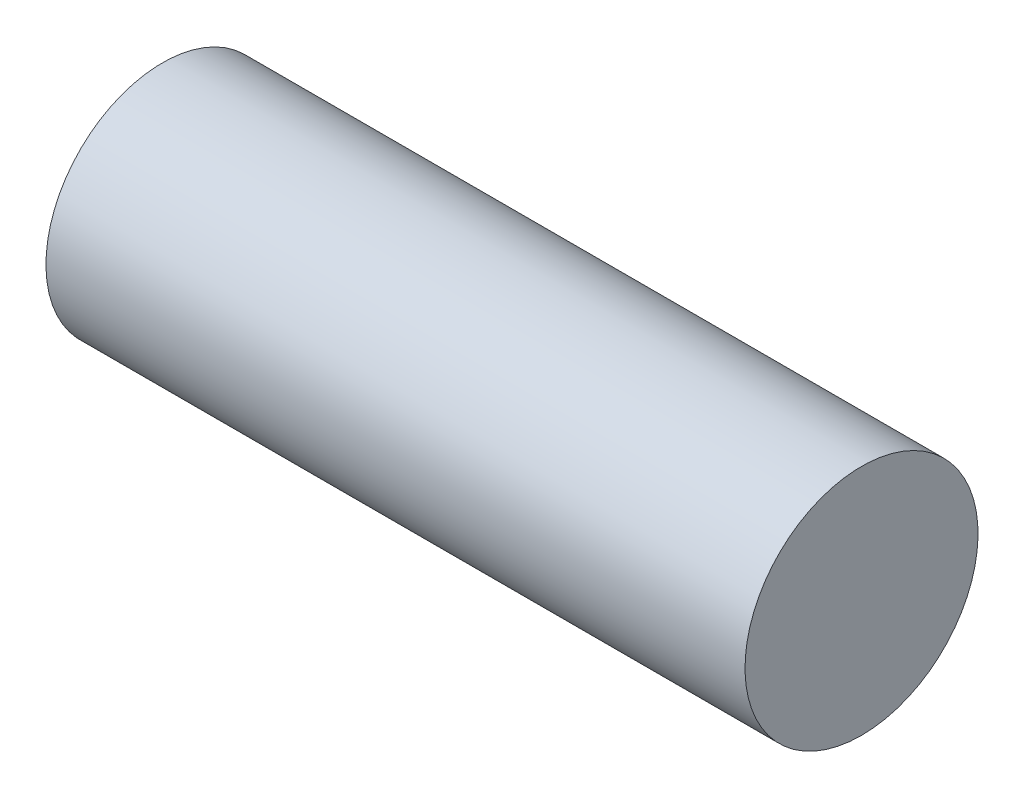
SolidWorks part; units mm, degrees
ref_plane "Plane1" through (0, 0, 0) normal (0, 0, 1) x (1, 0, 0)
ref_plane "Plane2" through (0, 0, 0) normal (0, 1, 0) x (1, 0, 0)
ref_plane "Plane3" through (0, 0, 0) normal (1, 0, 0) x (0, 0, -1)
other "Configuration Table"
sketch "BodySke" plane through (0, 0, 0) normal (0, 0, 1) x (1, 0, 0)
  line L0 (0, 0) -> (40.9091, 0) construction
  line L2 (0, 5) -> (30, 5)
  line L3 (30, 5) -> (30, 0)
  line L4 (0, 0) -> (30, 0)
  line L6 (0, 5) -> (0, 0)
  dimension "Diameter" = 10
  dimension "Length" = 30
revolve "Body" add sketch "BodySke" angle 360 about L0
